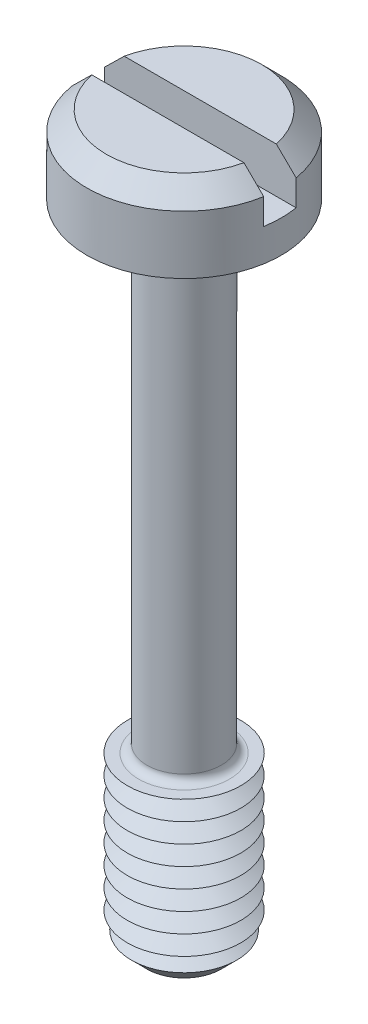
SolidWorks part; units mm, degrees
ref_plane "Front Plane" through (0, 0, 0) normal (0, 0, 1) x (1, 0, 0)
ref_plane "Top Plane" through (0, 0, 0) normal (0, 1, 0) x (1, 0, 0)
ref_plane "Right Plane" through (0, 0, 0) normal (1, 0, 0) x (0, 0, -1)
sketch "Sketch1" plane through (0, 0, 0) normal (0, 1, 0) x (1, 0, 0)
  circle A0 centre (0, 0) radius 3
  dimension "D1" = 6
extrude "Boss-Extrude1" add sketch "Sketch1" along normal blind 2.4
sketch "Sketch2" plane through (0, 0, 0) normal (0, -1, 0) x (1, 0, 0)
  circle A0 centre (0, 0) radius 1.15
  dimension "D1" = 2.3
extrude "Boss-Extrude2" add sketch "Sketch2" along normal blind 20
sketch "Sketch3" plane through (0, -20, 0) normal (0, -1, 0) x (1, 0, 0)
  circle A0 centre (0, 0) radius 1.75
  dimension "D1" = 3.5
extrude "Boss-Extrude3" add sketch "Sketch3" against normal blind 5.2
chamfer "Chamfer1" distance 0.6 angle 45 1 edges at (0, -20, -1.75)
sketch "Sketch4" plane through (0, 0, 0) normal (1, 0, 0) x (0, 0, -1)
  line L0 (0, -6.5871) -> (0, -12.0372) construction
sketch "Sketch5" plane through (0, 0, 0) normal (1, 0, 0) x (0, 0, -1)
  line L0 (-1.75, -14.8) -> (-1.2304, -15.1)
  line L1 (-1.2304, -15.1) -> (-1.75, -15.4)
  line L2 (-1.75, -14.8) -> (-1.75, -19.4) construction
  line L3 (-1.75, -15.4) -> (-1.75, -14.8)
  dimension "D1" = 0.6
revolve "Cut-Revolve1" cut sketch "Sketch5" angle 360 about L0
pattern_linear "LPattern1" count 8 spacing 0.6 along (0, -1, 0) of "Cut-Revolve1"
fillet "Fillet1" radius 0.25 2 edges at (0, -14.8, -1.15) (0, 0, -1.15)
chamfer "Chamfer2" distance 0.6 angle 45 1 edges at (0, 2.4, 3)
sketch "Sketch6" plane through (0, 2.4, 0) normal (0, 1, 0) x (1, 0, 0)
  line L1 (3, -0.5) -> (-3, -0.5)
  line L2 (3, -0.5) -> (3, 0.5)
  line L3 (3, 0.5) -> (-3, 0.5)
  line L4 (-3, -0.5) -> (-3, 0.5)
  line L5 (3, -0.5) -> (-3, 0.5) construction
  line L6 (3, 0.5) -> (-3, -0.5) construction
  circle A0 centre (0, 0) radius 3 construction
  point P0 (0, 0)
  dimension "D1" = 1
extrude "Cut-Extrude1" cut sketch "Sketch6" against normal blind 1.4
